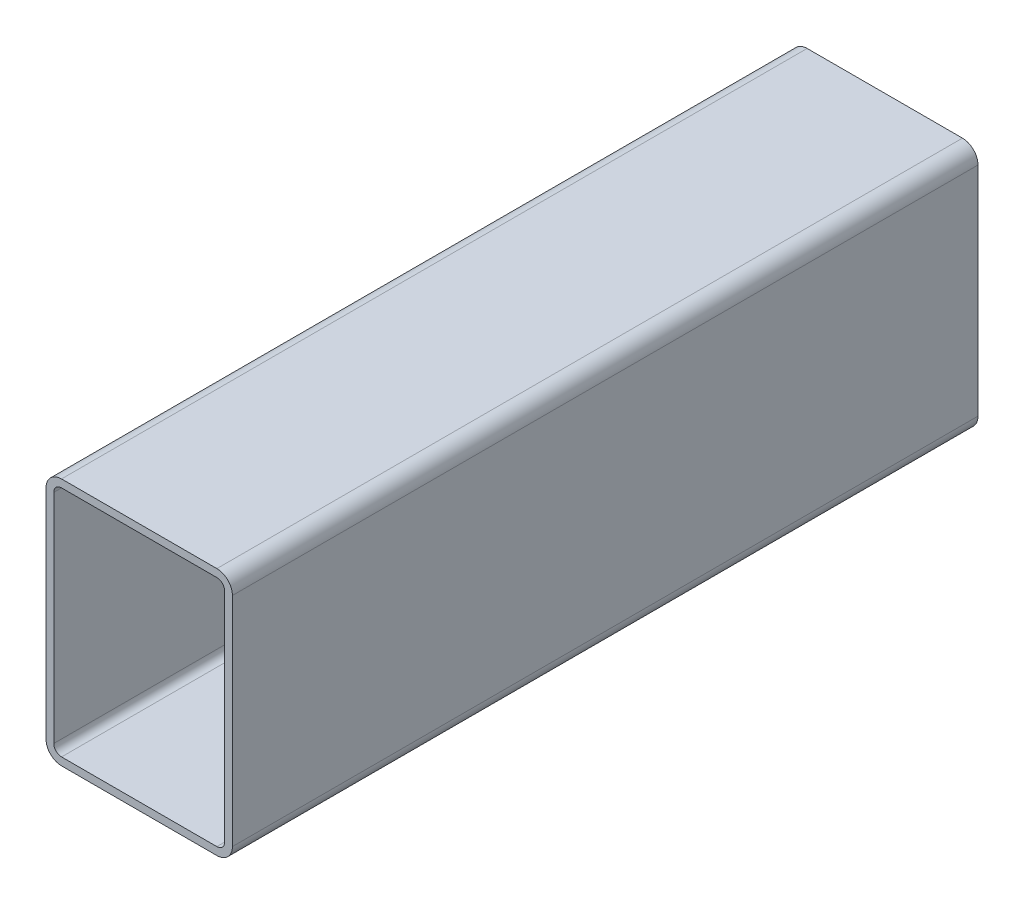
SolidWorks part; units mm, degrees
ref_plane "Front Plane" through (0, 0, 0) normal (0, 0, 1) x (1, 0, 0)
ref_plane "Top Plane" through (0, 0, 0) normal (0, 1, 0) x (1, 0, 0)
ref_plane "Right Plane" through (0, 0, 0) normal (1, 0, 0) x (0, 0, -1)
sketch "Sketch1" plane through (0, 0, 0) normal (0, 0, 1) x (1, 0, 0)
sketch_block_instance "HSS4x3x0.125-1"
sketch_block "HSS4x3x0.125"
extrude "Boss-Extrude1" add sketch "Sketch1" along normal blind 304.8
